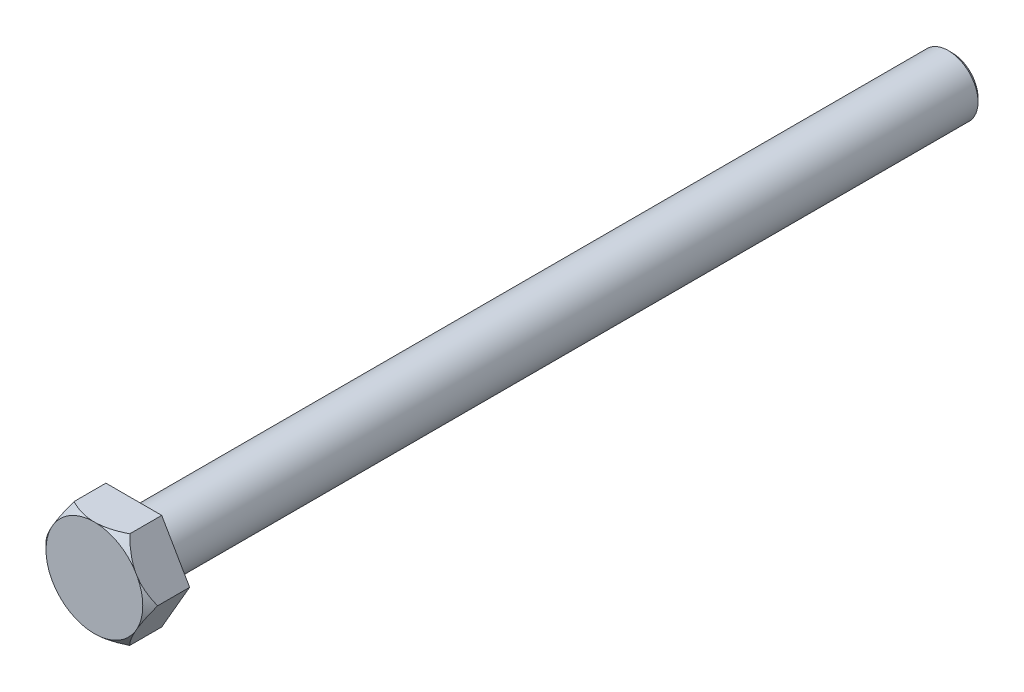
SolidWorks part; units mm, degrees
ref_plane "Plan de face" through (0, 0, 0) normal (0, 0, 1) x (1, 0, 0)
ref_plane "Plan de dessus" through (0, 0, 0) normal (0, 1, 0) x (1, 0, 0)
ref_plane "Plan de droite" through (0, 0, 0) normal (1, 0, 0) x (0, 0, -1)
sketch "Esquisse1" plane through (0, 0, 0) normal (0, 0, 1) x (1, 0, 0)
  line L1 (7.5056, 0) -> (3.7528, 6.5)
  line L2 (3.7528, 6.5) -> (-3.7528, 6.5)
  line L3 (-3.7528, 6.5) -> (-7.5056, 0)
  line L4 (-7.5056, 0) -> (-3.7528, -6.5)
  line L5 (-3.7528, -6.5) -> (3.7528, -6.5)
  line L6 (3.7528, -6.5) -> (7.5056, 0)
  circle A0 centre (0, 0) radius 6.5 construction
  dimension "D1" = 13
extrude "Boss.-Extru.1" add sketch "Esquisse1" along normal blind 5.3
sketch "Esquisse3" plane through (0, 0, 0) normal (0, 1, 0) x (1, 0, 0)
  line L0 (0, 2.9031) -> (0, -10.4428) construction
  line L1 (-7.5056, -4.3) -> (-6.5056, -5.3)
  line L2 (-9.0249, -6.1429) -> (-6.5056, -6.1429)
  line L3 (-9.0249, -6.1429) -> (-9.0249, -4.3)
  line L4 (-9.0249, -4.3) -> (-7.5056, -4.3)
  line L5 (-6.5056, -6.1429) -> (-6.5056, -5.3)
  line L6 (-7.5056, -5.3) -> (-7.5056, 0) construction
  line L8 (-3.7528, -5.3) -> (-7.5056, -5.3) construction
  dimension "D1" = 1
  dimension "D2" = 1
revolve "Enlèvement de matière-Révolution2" cut sketch "Esquisse3" angle 360 about L0
sketch "Esquisse4" plane through (0, 0, 0) normal (1, 0, 0) x (0, 0, -1)
  line L0 (0, 0) -> (83.8832, 0) construction
  line L1 (0, -4) -> (109.5, -4)
  line L2 (0, -6.5) -> (0, 0) construction
  line L3 (110, -3.5) -> (110, 0)
  line L4 (109.5, -4) -> (110, -3.5)
  line L5 (0, -4) -> (0, 0)
  line L6 (0, 0) -> (110, 0)
  point P4 (110, -4)
  dimension "D1" = 4
  dimension "D2" = 110
  dimension "D6" = 0.5
revolve "Révolution2" add sketch "Esquisse4" angle 360 about L0
